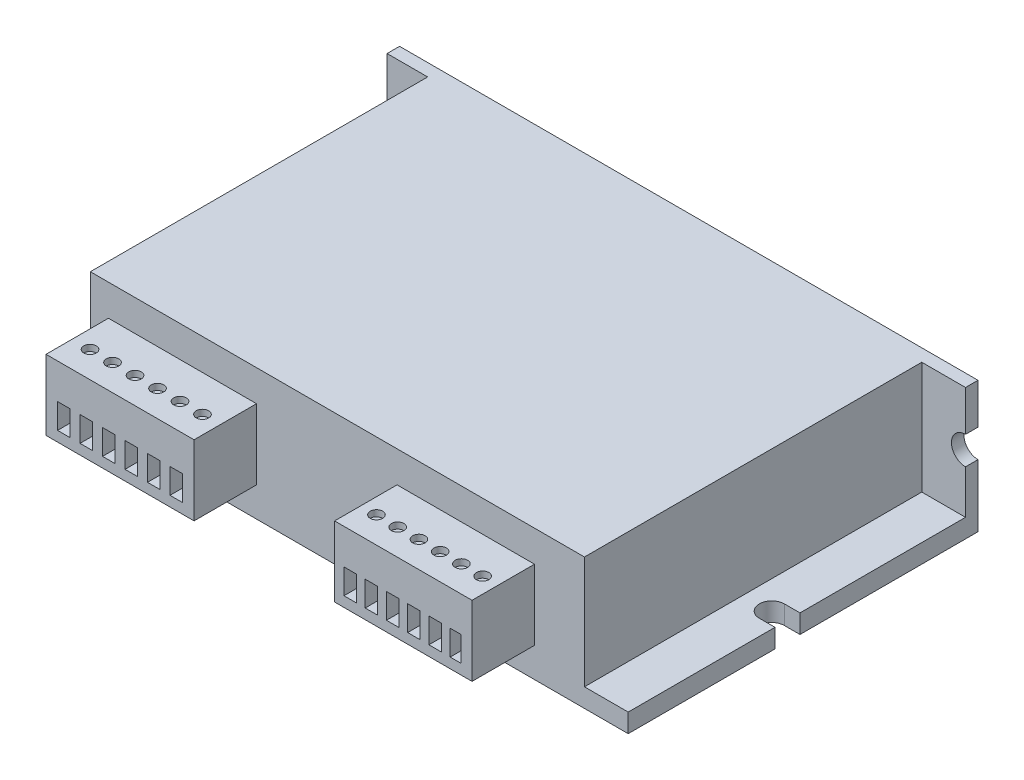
SolidWorks part; units mm, degrees
ref_plane "前视" through (0, 0, 0) normal (0, 0, 1) x (1, 0, 0)
ref_plane "上视" through (0, 0, 0) normal (0, 1, 0) x (1, 0, 0)
ref_plane "右视" through (0, 0, 0) normal (1, 0, 0) x (0, 0, -1)
sketch "草图1" plane through (0, 0, 0) normal (0, 1, 0) x (1, 0, 0)
  line L1 (0, 0) -> (92.6, 0)
  line L2 (0, 0) -> (0, 56)
  line L3 (0, 56) -> (92.6, 56)
  line L4 (92.6, 0) -> (92.6, 56)
extrude "凸台-拉伸1" add sketch "草图1" along normal blind 3
ref_plane "基准面1" through (0, 3, 0) normal (0, 1, 0) x (1, 0, 0)
sketch "草图2" plane through (0, 3, 0) normal (0, 1, 0) x (1, 0, 0)
  line L0 (92.6, 0) -> (92.6, 56) construction
  line L1 (0, 56) -> (92.6, 56)
  line L2 (0, 56) -> (0, 54)
  line L3 (0, 54) -> (92.6, 54)
  line L4 (92.6, 56) -> (92.6, 54)
extrude "凸台-拉伸2" add sketch "草图2" along normal blind 18
sketch "草图3" plane through (0, 3, 0) normal (0, 1, 0) x (1, 0, 0)
  line L0 (0, 54) -> (92.6, 54) construction
  line L1 (6.5, 54) -> (85.6, 54)
  line L2 (6.5, 54) -> (6.5, 0)
  line L3 (6.5, 0) -> (85.6, 0)
  line L4 (85.6, 54) -> (85.6, 0)
  line L5 (0, 0) -> (92.6, 0) construction
extrude "凸台-拉伸3" add sketch "草图3" along normal blind 18
sketch "草图4" plane through (0, 3, 0) normal (0, 1, 0) x (1, 0, 0)
  line L0 (0, 54) -> (0, 0) construction
  line L1 (0, 27.5) -> (2.5, 27.5)
  line L2 (0, 27.5) -> (0, 23.5)
  line L3 (0, 23.5) -> (2.5, 23.5)
  line L5 (92.6, 0) -> (92.6, 54) construction
  line L6 (92.6, 27.5) -> (90.1, 27.5)
  line L7 (92.6, 27.5) -> (92.6, 23.5)
  line L8 (92.6, 23.5) -> (90.1, 23.5)
  arc A0 (90.1, 27.5) -> (90.1, 23.5) centre (90.1, 25.5) ccw
  arc A1 (2.5, 27.5) -> (2.5, 23.5) centre (2.5, 25.5) cw
  dimension "D1" = 2
  dimension "D2" = 2
extrude "切除-拉伸1" cut sketch "草图4" against normal blind 3
ref_plane "基准面2" through (0, 0, -56) normal (0, 0, -1) x (-1, 0, 0)
sketch "草图5" plane through (0, 0, -56) normal (0, 0, -1) x (-1, 0, 0)
  line L0 (-92.6, 21) -> (-92.6, 0) construction
  line L1 (0, 21) -> (0, 0) construction
  line L2 (0, 14.5) -> (0, 10)
  line L3 (-92.6, 14.5) -> (-92.6, 10)
  arc A0 (-92.6, 10) -> (-92.6, 14.5) centre (-92.6, 12.25) ccw
  arc A1 (0, 14.5) -> (0, 10) centre (0, 12.25) ccw
  dimension "D1" = 2.25
  dimension "D2" = 2.25
extrude "切除-拉伸2" cut sketch "草图5" against normal blind 2
ref_plane "基准面3" through (0, 0, 0) normal (0, 0, 1) x (1, 0, 0)
sketch "草图6" plane through (0, 0, 0) normal (0, 0, 1) x (1, 0, 0)
  line L1 (9.4, 16) -> (33.1, 16)
  line L2 (9.4, 16) -> (9.4, 4.75)
  line L3 (9.4, 4.75) -> (33.1, 4.75)
  line L4 (33.1, 16) -> (33.1, 4.75)
  line L5 (55.6, 16) -> (77.6, 16)
  line L6 (55.6, 16) -> (55.6, 4.75)
  line L7 (55.6, 4.75) -> (77.6, 4.75)
  line L8 (77.6, 16) -> (77.6, 4.75)
extrude "凸台-拉伸4" add sketch "草图6" along normal blind 10
ref_plane "基准面4" through (0, 16, 0) normal (0, 1, 0) x (1, 0, 0)
sketch "草图7" plane through (0, 16, 0) normal (0, 1, 0) x (1, 0, 0)
  circle A0 centre (12.25, -5.8) radius 1
  circle A1 centre (15.85, -5.8) radius 1
  circle A2 centre (19.45, -5.8) radius 1
  circle A3 centre (23.05, -5.8) radius 1
  circle A4 centre (26.65, -5.8) radius 1
  circle A5 centre (30.25, -5.8) radius 1
  circle A6 centre (58.1, -5.8) radius 1
  circle A7 centre (61.5, -5.8) radius 1
  circle A8 centre (64.9, -5.8) radius 1
  circle A9 centre (68.3, -5.8) radius 1
  circle A10 centre (71.7, -5.8) radius 1
  circle A11 centre (75.1, -5.8) radius 1
extrude "切除-拉伸3" cut sketch "草图7" against normal blind 1
ref_plane "基准面5" through (0, 0, 10) normal (0, 0, 1) x (1, 0, 0)
sketch "草图8" plane through (0, 0, 10) normal (0, 0, 1) x (1, 0, 0)
  line L3 (11.25, 10.375) -> (13.25, 10.375)
  line L4 (11.25, 10.375) -> (11.25, 6.375)
  line L5 (11.25, 6.375) -> (13.25, 6.375)
  line L6 (13.25, 10.375) -> (13.25, 6.375)
  line L12 (14.85, 10.375) -> (16.85, 10.375)
  line L13 (14.85, 10.375) -> (14.85, 6.375)
  line L14 (14.85, 6.375) -> (16.85, 6.375)
  line L15 (16.85, 10.375) -> (16.85, 6.375)
  line L16 (18.45, 10.375) -> (20.45, 10.375)
  line L17 (18.45, 10.375) -> (18.45, 6.375)
  line L18 (18.45, 6.375) -> (20.45, 6.375)
  line L19 (20.45, 10.375) -> (20.45, 6.375)
  line L20 (22.05, 10.375) -> (24.05, 10.375)
  line L21 (22.05, 10.375) -> (22.05, 6.375)
  line L22 (22.05, 6.375) -> (24.05, 6.375)
  line L23 (24.05, 10.375) -> (24.05, 6.375)
  line L24 (25.65, 10.375) -> (27.65, 10.375)
  line L25 (25.65, 10.375) -> (25.65, 6.375)
  line L26 (25.65, 6.375) -> (27.65, 6.375)
  line L27 (27.65, 10.375) -> (27.65, 6.375)
  line L28 (29.25, 10.375) -> (31.25, 10.375)
  line L29 (29.25, 10.375) -> (29.25, 6.375)
  line L30 (29.25, 6.375) -> (31.25, 6.375)
  line L31 (31.25, 10.375) -> (31.25, 6.375)
  line L33 (57.1, 10.375) -> (59.1, 10.375)
  line L34 (57.1, 10.375) -> (57.1, 6.375)
  line L35 (57.1, 6.375) -> (59.1, 6.375)
  line L36 (59.1, 10.375) -> (59.1, 6.375)
  line L37 (60.5, 10.375) -> (62.5, 10.375)
  line L38 (60.5, 10.375) -> (60.5, 6.375)
  line L39 (60.5, 6.375) -> (62.5, 6.375)
  line L40 (62.5, 10.375) -> (62.5, 6.375)
  line L41 (63.9, 10.375) -> (65.9, 10.375)
  line L42 (63.9, 10.375) -> (63.9, 6.375)
  line L43 (63.9, 6.375) -> (65.9, 6.375)
  line L44 (65.9, 10.375) -> (65.9, 6.375)
  line L45 (67.3, 10.375) -> (69.3, 10.375)
  line L46 (67.3, 10.375) -> (67.3, 6.375)
  line L47 (67.3, 6.375) -> (69.3, 6.375)
  line L48 (69.3, 10.375) -> (69.3, 6.375)
  line L49 (70.7, 10.375) -> (72.7, 10.375)
  line L50 (70.7, 10.375) -> (70.7, 6.375)
  line L51 (70.7, 6.375) -> (72.7, 6.375)
  line L52 (72.7, 10.375) -> (72.7, 6.375)
  line L53 (74.1, 10.375) -> (75.87, 10.375)
  line L54 (74.1, 10.375) -> (74.1, 6.375)
  line L55 (74.1, 6.375) -> (75.87, 6.375)
  line L56 (75.87, 10.375) -> (75.87, 6.375)
extrude "切除-拉伸4" cut sketch "草图8" against normal blind 3
